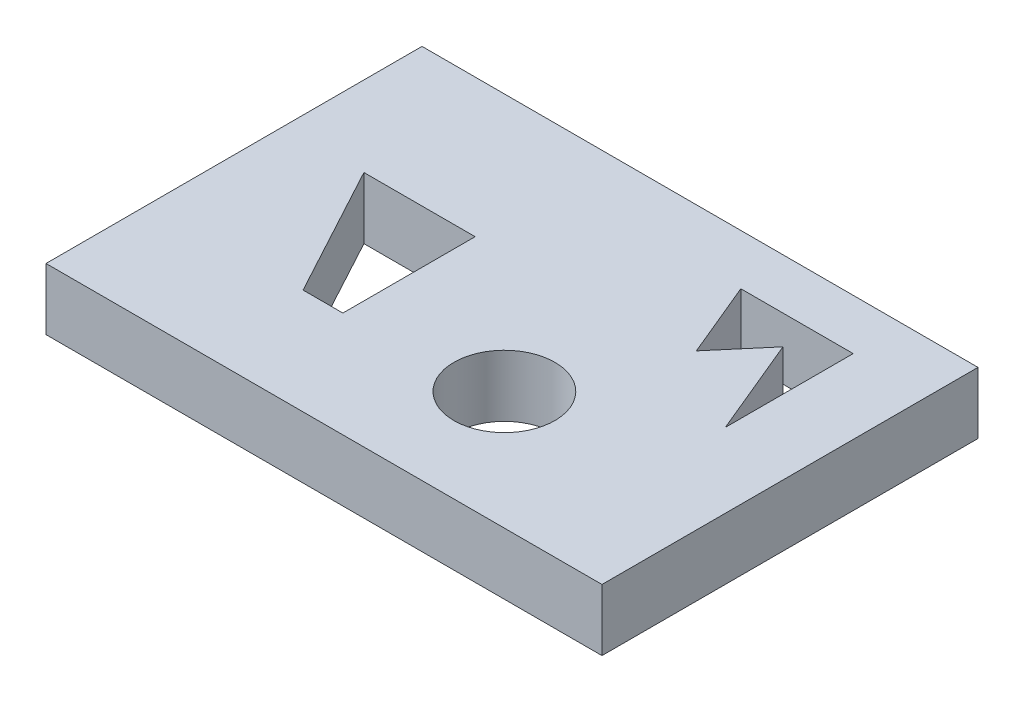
SolidWorks part; units mm, degrees
ref_plane "Front Plane" through (0, 0, 0) normal (0, 0, 1) x (1, 0, 0)
ref_plane "Top Plane" through (0, 0, 0) normal (0, 1, 0) x (1, 0, 0)
ref_plane "Right Plane" through (0, 0, 0) normal (1, 0, 0) x (0, 0, -1)
sketch "Sketch1" plane through (0, 0, 0) normal (0, 1, 0) x (1, 0, 0)
  line L1 (-105.4776, 74.1903) -> (114.4703, 74.1903)
  line L2 (-105.4776, 74.1903) -> (-105.4776, -74.565)
  line L3 (-105.4776, -74.565) -> (114.4703, -74.565)
  line L4 (114.4703, 74.1903) -> (114.4703, -74.565)
extrude "Extrude1" add sketch "Sketch1" against normal blind 24.384
sketch "Sketch2" plane through (0, 0, 0) normal (0, 1, 0) x (-1, 0, 0)
  line L0 (-85.0675, -54.2213) -> (-40.6145, -54.2213)
  line L1 (-40.6145, -54.2213) -> (-53.1169, -24.1229)
  line L2 (-53.1169, -24.1229) -> (-68.8607, -42.645)
  line L3 (-68.8607, -42.645) -> (-85.0675, -3.6285)
  line L4 (-85.0675, -3.6285) -> (-85.0675, -54.2213)
  line L5 (29.7695, -19.4924) -> (29.7695, 32.8326)
  line L6 (29.7695, 32.8326) -> (45.5133, 32.8326)
  line L7 (45.5133, 32.8326) -> (73.7595, -19.4924)
  line L8 (73.7595, -19.4924) -> (29.7695, -19.4924)
  circle A0 centre (-29.0382, 27.739) radius 19.9758
extrude "Cut-Extrude1" cut sketch "Sketch2" against normal through all
